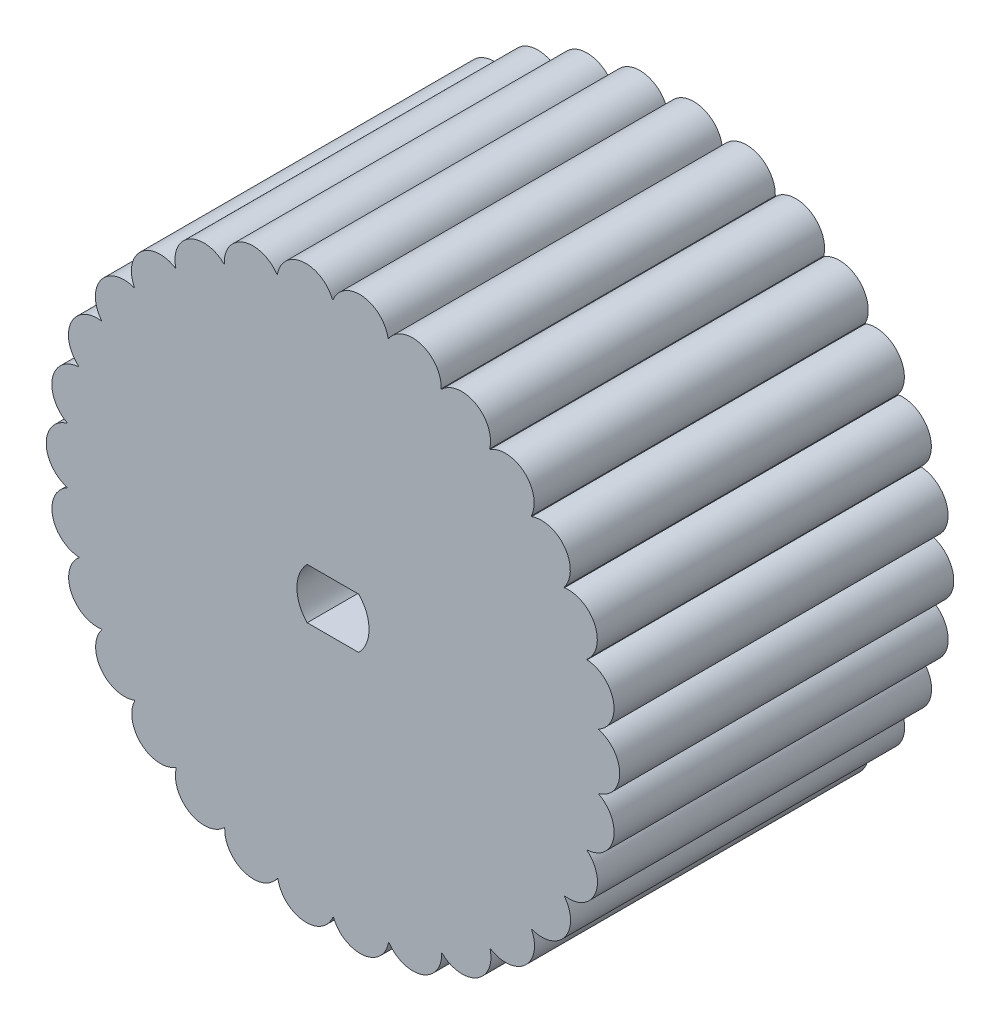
SolidWorks part; units mm, degrees
ref_plane "Alzado" through (0, 0, 0) normal (0, 0, 1) x (1, 0, 0)
ref_plane "Planta" through (0, 0, 0) normal (0, 1, 0) x (1, 0, 0)
ref_plane "Vista lateral" through (0, 0, 0) normal (1, 0, 0) x (0, 0, -1)
sketch "Croquis1" plane through (0, 0, 0) normal (0, 0, 1) x (1, 0, 0)
  line L4 (-1.9282, -1.89) -> (1.9282, -1.89)
  line L5 (-1.9282, 1.89) -> (1.9282, 1.89)
  arc A0 (-1.9282, 1.89) -> (-1.9282, -1.89) centre (0, 0) ccw
  arc A1 (1.9282, -1.89) -> (1.9282, 1.89) centre (0, 0) ccw
  arc A4 (0, 20) -> (-0.0375, 20) centre (0, 0) ccw
  arc A5 (0, 20) -> (4.1215, 19.5707) centre (1.9998, 19.2) cw
  arc A6 (4.1582, 19.563) -> (8.1004, 18.2861) centre (5.948, 18.3647) cw
  arc A7 (8.1347, 18.2709) -> (11.7253, 16.2024) centre (9.6362, 16.7267) cw
  arc A8 (11.7557, 16.1803) -> (14.8378, 13.4105) centre (12.9033, 14.3577) cw
  arc A9 (14.8629, 13.3826) -> (17.3017, 10.0325) centre (15.6065, 11.3612) cw
  arc A10 (17.3205, 10) -> (19.0095, 6.216) centre (17.6276, 7.8681) cw
  arc A11 (19.0211, 6.1803) -> (19.8865, 2.1279) centre (18.8783, 4.0312) cw
  arc A12 (19.8904, 2.0906) -> (19.8943, -2.0532) centre (19.3039, 0.0181) cw
  arc A13 (19.8904, -2.0906) -> (19.0327, -6.1446) centre (18.8858, -3.9958) cw
  arc A14 (19.0211, -6.1803) -> (17.3392, -9.9675) centre (17.6423, -7.835) cw
  arc A15 (17.3205, -10) -> (14.888, -13.3547) centre (15.6278, -11.3319) cw
  arc A16 (14.8629, -13.3826) -> (11.786, -16.1583) centre (12.9303, -14.3334) cw
  arc A17 (11.7557, -16.1803) -> (8.169, -18.2556) centre (9.6676, -16.7086) cw
  arc A18 (8.1347, -18.2709) -> (4.1949, -19.5551) centre (5.9824, -18.3535) cw
  arc A19 (4.1582, -19.563) -> (0.0375, -20) centre (2.0358, -19.1962) cw
  arc A20 (0, -20) -> (-4.1215, -19.5707) centre (-1.9998, -19.2) cw
  arc A21 (-4.1582, -19.563) -> (-8.1004, -18.2861) centre (-5.948, -18.3647) cw
  arc A22 (-8.1347, -18.2709) -> (-11.7253, -16.2024) centre (-9.6362, -16.7267) cw
  arc A23 (-11.7557, -16.1803) -> (-14.8378, -13.4105) centre (-12.9033, -14.3577) cw
  arc A24 (-14.8629, -13.3826) -> (-17.3017, -10.0325) centre (-15.6065, -11.3612) cw
  arc A25 (-17.3205, -10) -> (-19.0095, -6.216) centre (-17.6276, -7.8681) cw
  arc A26 (-19.0211, -6.1803) -> (-19.8865, -2.1279) centre (-18.8783, -4.0312) cw
  arc A27 (-19.8904, -2.0906) -> (-19.8943, 2.0532) centre (-19.3039, -0.0181) cw
  arc A28 (-19.8904, 2.0906) -> (-19.0327, 6.1446) centre (-18.8858, 3.9958) cw
  arc A29 (-19.0211, 6.1803) -> (-17.3392, 9.9675) centre (-17.6423, 7.835) cw
  arc A30 (-17.3205, 10) -> (-14.888, 13.3547) centre (-15.6278, 11.3319) cw
  arc A31 (-14.8629, 13.3826) -> (-11.786, 16.1583) centre (-12.9303, 14.3334) cw
  arc A32 (-11.7557, 16.1803) -> (-8.169, 18.2556) centre (-9.6676, 16.7086) cw
  arc A33 (-8.1347, 18.2709) -> (-4.1949, 19.5551) centre (-5.9824, 18.3535) cw
  arc A34 (-4.1582, 19.563) -> (-0.0375, 20) centre (-2.0358, 19.1962) cw
  arc A35 (4.1582, 19.563) -> (4.1215, 19.5707) centre (0, 0) ccw
  arc A36 (-4.1582, 19.563) -> (-4.1949, 19.5551) centre (0, 0) ccw
  arc A37 (-8.1347, 18.2709) -> (-8.169, 18.2556) centre (0, 0) ccw
  arc A38 (-14.8629, 13.3826) -> (-14.888, 13.3547) centre (0, 0) ccw
  arc A39 (-11.7557, 16.1803) -> (-11.786, 16.1583) centre (0, 0) ccw
  arc A40 (-17.3205, 10) -> (-17.3392, 9.9675) centre (0, 0) ccw
  arc A41 (-19.0211, 6.1803) -> (-19.0327, 6.1446) centre (0, 0) ccw
  arc A42 (-19.8904, 2.0906) -> (-19.8943, 2.0532) centre (0, 0) ccw
  arc A43 (-19.8904, -2.0906) -> (-19.8865, -2.1279) centre (0, 0) ccw
  arc A44 (-19.0211, -6.1803) -> (-19.0095, -6.216) centre (0, 0) ccw
  arc A45 (-17.3205, -10) -> (-17.3017, -10.0325) centre (0, 0) ccw
  arc A46 (-14.8629, -13.3826) -> (-14.8378, -13.4105) centre (0, 0) ccw
  arc A47 (-11.7557, -16.1803) -> (-11.7253, -16.2024) centre (0, 0) ccw
  arc A48 (-8.1347, -18.2709) -> (-8.1004, -18.2861) centre (0, 0) ccw
  arc A49 (-4.1582, -19.563) -> (-4.1215, -19.5707) centre (0, 0) ccw
  arc A50 (0, -20) -> (0.0375, -20) centre (0, 0) ccw
  arc A51 (4.1582, -19.563) -> (4.1949, -19.5551) centre (0, 0) ccw
  arc A52 (8.1347, -18.2709) -> (8.169, -18.2556) centre (0, 0) ccw
  arc A53 (11.7557, -16.1803) -> (11.786, -16.1583) centre (0, 0) ccw
  arc A54 (17.3205, -10) -> (17.3392, -9.9675) centre (0, 0) ccw
  arc A55 (14.8629, -13.3826) -> (14.888, -13.3547) centre (0, 0) ccw
  arc A56 (19.0211, -6.1803) -> (19.0327, -6.1446) centre (0, 0) ccw
  arc A57 (19.8904, -2.0906) -> (19.8943, -2.0532) centre (0, 0) ccw
  arc A58 (19.8904, 2.0906) -> (19.8865, 2.1279) centre (0, 0) ccw
  arc A59 (19.0211, 6.1803) -> (19.0095, 6.216) centre (0, 0) ccw
  arc A60 (17.3205, 10) -> (17.3017, 10.0325) centre (0, 0) ccw
  arc A61 (14.8629, 13.3826) -> (14.8378, 13.4105) centre (0, 0) ccw
  arc A62 (11.7557, 16.1803) -> (11.7253, 16.2024) centre (0, 0) ccw
  arc A63 (8.1347, 18.2709) -> (8.1004, 18.2861) centre (0, 0) ccw
  point P2 (-14.2, 14.6994)
  point P3 (-8.8, 14.6994)
  point P4 (-14.2, 18.4794)
  point P5 (-8.8, 18.4794)
  point P108 (0, 0)
  dimension "D2" = 40
  dimension "D1" = 30
extrude "Saliente-Extruir1" add sketch "Croquis1" along normal blind 25
